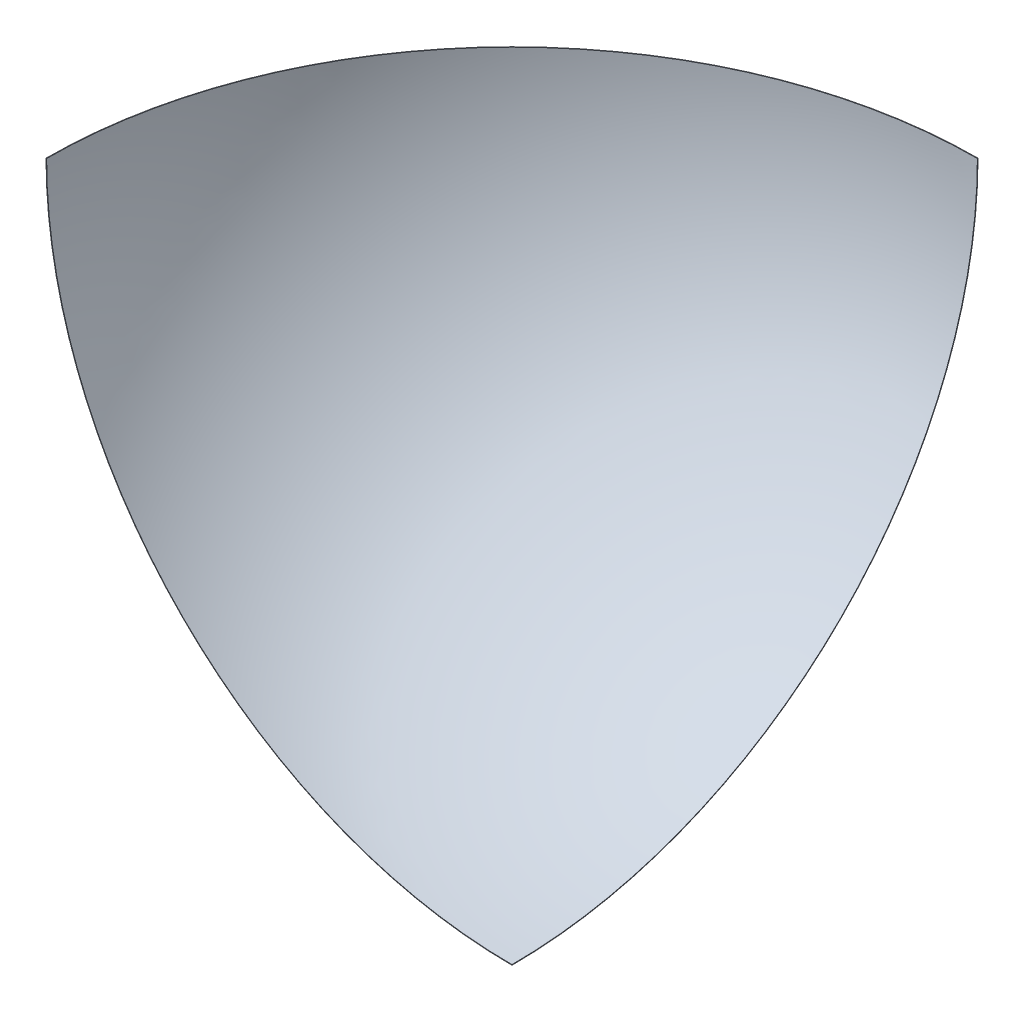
SolidWorks part; units mm, degrees
ref_plane "Front Plane" through (0, 0, 0) normal (1, 0, 0) x (0, 1, 0)
ref_plane "Top Plane" through (0, 0, 0) normal (0, 0, 1) x (0, 1, 0)
ref_plane "Right Plane" through (0, 0, 0) normal (0, 1, 0) x (-1, 0, 0)
sketch "sk profile 1" plane through (0, 0, 0) normal (0, 1, 0) x (-1, 0, 0)
  point P0 (0, 0)
  line B0 (-465.1422, -1224.28) -> (0, -1224.28)
  line B1 (-465.1422, -1222.6925) -> (0, -1222.6925)
  line B2 (1224.28, 0) -> (1224.28, 75.92)
  line B3 (1222.6925, 0) -> (1222.6925, 75.92)
  line B4 (1222.6925, 75.92) -> (1224.28, 75.92)
  line B5 (-465.1422, -1222.6925) -> (-465.1422, -1224.28)
  arc B6 (0, -1224.28) -> (1224.28, 0) centre (0, 0) ccw
  arc B7 (0, -1222.6925) -> (1222.6925, 0) centre (0, 0) ccw
sketch_block_instance "Block1-1"
sketch_block "Block1" parameters "D1"=1224.28, "D2"=1222.6925, "D3"=1.5875
sketch "Sketch9" plane through (0, 0, 0) normal (1, 0, 0) x (0, 1, 0)
  point P0 (0, 0)
  line B0 (465.1422, -1224.28) -> (0, -1224.28)
  line B1 (465.1422, -1222.6925) -> (0, -1222.6925)
  line B2 (-1224.28, 0) -> (-1224.28, 75.92)
  line B3 (-1222.6925, 0) -> (-1222.6925, 75.92)
  arc B4 (0, -1224.28) -> (-1224.28, 0) centre (0, 0) cw
  arc B5 (0, -1222.6925) -> (-1222.6925, 0) centre (0, 0) cw
sketch_block_instance "Block1-4"
sketch "sk axis" plane through (0, 0, 0) normal (0, 1, 0) x (-1, 0, 0)
  line L0 (0, -1224.28) -> (0, -1052.9889)
ref_axis "Axis1" through (0, 0, -1224.28) along (0, 0, 1)
sketch "Sketch8" plane through (0, 0, 0) normal (0, 1, 0) x (-1, 0, 0)
  line L0 (1222.6925, 0) -> (1224.28, 0)
  line L1 (0, -1222.6925) -> (0, -1224.28)
  arc A0 (0, -1224.28) -> (1224.28, 0) centre (0, 0) ccw
  arc A1 (0, -1224.28) -> (1224.28, 0) centre (0, 0) ccw construction
  arc A2 (0, -1222.6925) -> (1222.6925, 0) centre (0, 0) ccw
  dimension "D1" = 1.5875
revolve "Revolve2" add sketch "Sketch8" angle 90 about axis through (0, 0, -1224.28) along (0, 0, 1)
